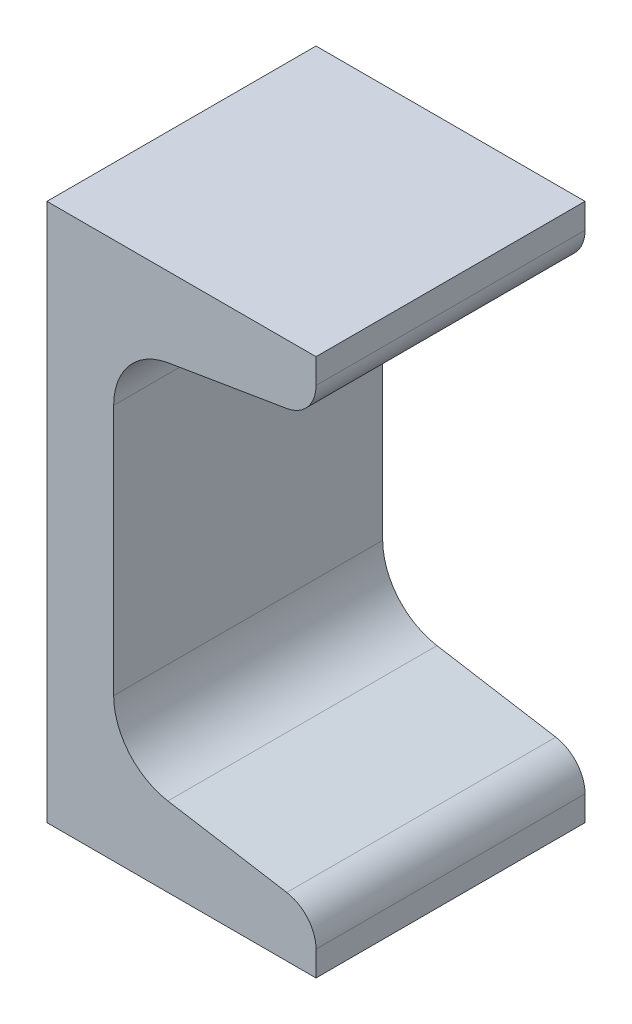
SolidWorks part; units mm, degrees
ref_plane "Plane1" through (0, 0, 0) normal (0, 0, 1) x (1, 0, 0)
ref_plane "Plane2" through (0, 0, 0) normal (0, 1, 0) x (-1, 0, 0)
ref_plane "Plane3" through (0, 0, 0) normal (1, 0, 0) x (0, 0, -1)
sketch "Sketch1" plane through (0, 0, 0) normal (0, 0, 1) x (1, 0, 0)
  line L0 (0, 0) -> (0, 50.8)
  line L1 (0, 50.8) -> (25.4, 50.8)
  line L2 (0, 0) -> (25.4, 0)
  line L3 (7.8492, 0) -> (-7.8492, 0) construction
  line L4 (0, -15.6984) -> (0, 15.6984) construction
  line L5 (31.75, 6.7469) -> (6.35, 6.7469) construction
  line L12 (6.2965, 37.2673) -> (6.2965, 13.5327)
  line L15 (25.4, 50.8) -> (25.4, 48.4424)
  line L16 (25.4, 0) -> (25.4, 2.3576)
  line L17 (11.4196, 43.315) -> (22.6409, 45.1853)
  line L18 (11.4196, 7.485) -> (22.6409, 5.6147)
  arc A9 (6.2965, 13.5327) -> (11.4196, 7.485) centre (12.4276, 13.5327) ccw
  arc A10 (6.2965, 37.2673) -> (11.4196, 43.315) centre (12.4276, 37.2673) cw
  arc A11 (25.4, 48.4424) -> (22.6409, 45.1853) centre (22.098, 48.4424) cw
  arc A12 (25.4, 2.3576) -> (22.6409, 5.6147) centre (22.098, 2.3576) ccw
  dimension "RI" = 6.1311
  dimension "D2" = 9.463
  dimension "RA" = 3.302
  dimension "Depth" = 50.8
  dimension "BF" = 25.4
  dimension "TW" = 6.2965
  dimension "flange" = 2.3576
  dimension "TF" = 6.7469
extrude "BaseChannel" add sketch "Sketch1" along normal mid plane 25.4
equation "\"flange@Sketch1\" = \"TF@Sketch1\" -  ( \"RA@Sketch1\" * cos(\"D2@Sketch1\"/180*3.141592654))-((((\"BF@Sketch1\"-\"TW@Sketch1\")/2)-(\"RA@Sketch1\"-\"RA@Sketch1\"*sin(\"D2@Sketch1\"/180*3.141592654)))*tan(\"D2@Sketch1\""
